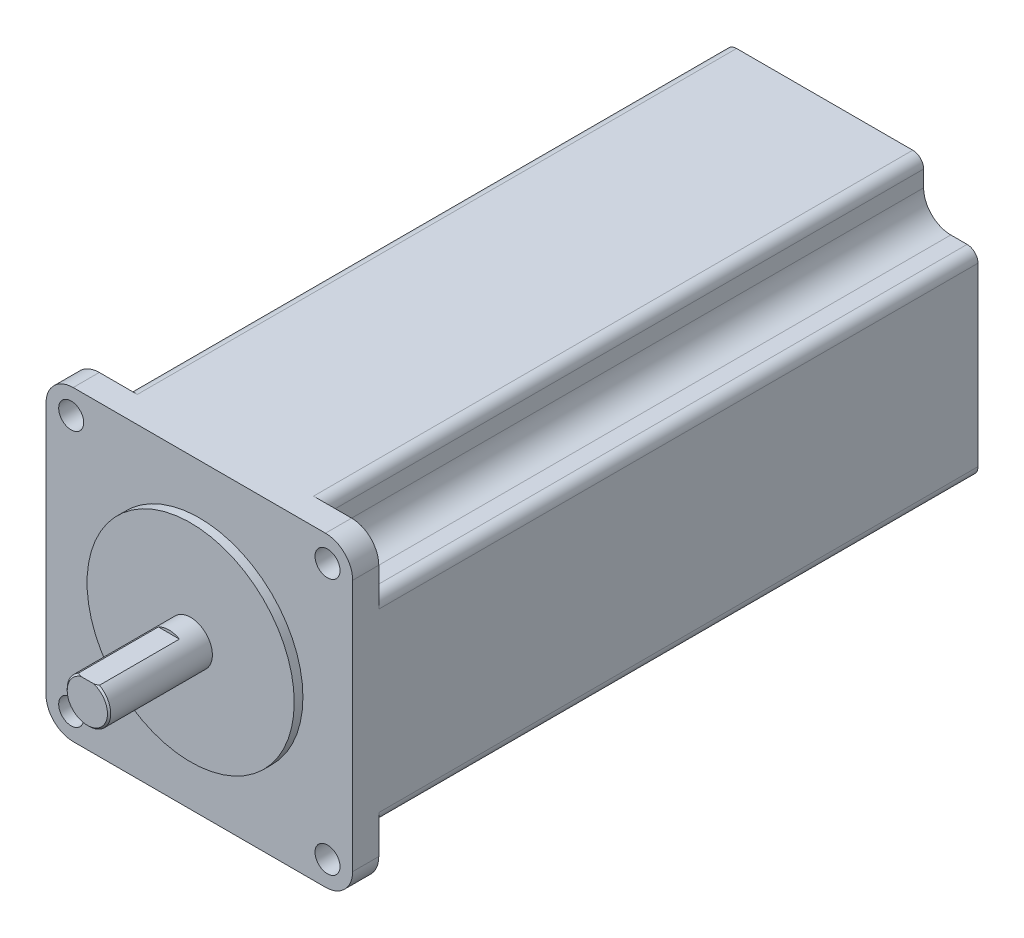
SolidWorks part; units mm, degrees
ref_plane "前视基准面" through (0, 0, 0) normal (0, 0, 1) x (1, 0, 0)
ref_plane "上视基准面" through (0, 0, 0) normal (0, 1, 0) x (1, 0, 0)
ref_plane "右视基准面" through (0, 0, 0) normal (1, 0, 0) x (0, 0, -1)
sketch "草图1" plane through (0, 0, 0) normal (0, 0, 1) x (1, 0, 0)
  circle A0 centre (0, 0) radius 19.05
extrude "凸台-拉伸1" add sketch "草图1" against normal blind 1.6
sketch "草图2" plane through (0, 0, 0) normal (0, 0, 1) x (1, 0, 0)
  circle A0 centre (0, 0) radius 4
extrude "凸台-拉伸2" add sketch "草图2" along normal blind 19
sketch "草图4" plane through (0, 0, -1.6) normal (0, 0, -1) x (-1, 0, 0)
  line L1 (0, 28.2) -> (23.2, 28.2)
  line L2 (28.2, 23.2) -> (28.2, -23.2)
  line L3 (23.2, -28.2) -> (-23.2, -28.2)
  line L4 (-28.2, -23.2) -> (-28.2, 23.2)
  line L5 (-23.2, 28.2) -> (0, 28.2)
  arc A0 (-23.2, -28.2) -> (-28.2, -23.2) centre (-23.2, -23.2) cw
  arc A1 (28.2, -23.2) -> (23.2, -28.2) centre (23.2, -23.2) cw
  arc A2 (23.2, 28.2) -> (28.2, 23.2) centre (23.2, 23.2) cw
  arc A3 (-28.2, 23.2) -> (-23.2, 28.2) centre (-23.2, 23.2) cw
  dimension "D1" = 5
extrude "凸台-拉伸3" add sketch "草图4" along normal blind 115
sketch "草图5" plane through (0, 0, -116.6) normal (0, 0, -1) x (-1, 0, 0)
  line L1 (23.2, 28.2) -> (-23.2, 28.2) construction
  line L2 (11.4944, 28.2) -> (16.2, 28.2)
  line L3 (18.2, 26.2) -> (18.2, 23.2)
  line L4 (23.2, 18.2) -> (26.2, 18.2)
  line L5 (28.2, -23.2) -> (28.2, 23.2) construction
  line L6 (28.2, 16.2) -> (28.2, 9.9204)
  line L7 (28.2, 9.9204) -> (36.4601, 9.9204)
  line L8 (36.4601, 9.9204) -> (36.4601, 32.1771)
  line L9 (36.4601, 32.1771) -> (11.4944, 32.1771)
  line L10 (11.4944, 32.1771) -> (11.4944, 28.2)
  line L12 (-11.4944, 32.1771) -> (-11.4944, 28.2)
  line L13 (-36.4601, 32.1771) -> (-11.4944, 32.1771)
  line L14 (-36.4601, 9.9204) -> (-36.4601, 32.1771)
  line L15 (-28.2, 9.9204) -> (-36.4601, 9.9204)
  line L16 (-28.2, 16.2) -> (-28.2, 9.9204)
  line L17 (-23.2, 18.2) -> (-26.2, 18.2)
  line L18 (-18.2, 26.2) -> (-18.2, 23.2)
  line L19 (-11.4944, 28.2) -> (-16.2, 28.2)
  line L20 (11.4944, -32.1771) -> (11.4944, -28.2)
  line L21 (36.4601, -32.1771) -> (11.4944, -32.1771)
  line L22 (36.4601, -9.9204) -> (36.4601, -32.1771)
  line L23 (28.2, -9.9204) -> (36.4601, -9.9204)
  line L24 (28.2, -16.2) -> (28.2, -9.9204)
  line L25 (23.2, -18.2) -> (26.2, -18.2)
  line L26 (18.2, -26.2) -> (18.2, -23.2)
  line L27 (11.4944, -28.2) -> (16.2, -28.2)
  line L28 (-11.4944, -28.2) -> (-16.2, -28.2)
  line L29 (-18.2, -26.2) -> (-18.2, -23.2)
  line L30 (-23.2, -18.2) -> (-26.2, -18.2)
  line L31 (-28.2, -16.2) -> (-28.2, -9.9204)
  line L32 (-28.2, -9.9204) -> (-36.4601, -9.9204)
  line L33 (-36.4601, -9.9204) -> (-36.4601, -32.1771)
  line L34 (-36.4601, -32.1771) -> (-11.4944, -32.1771)
  line L35 (-11.4944, -32.1771) -> (-11.4944, -28.2)
  arc A0 (18.2, 23.2) -> (23.2, 18.2) centre (23.2, 23.2) ccw
  arc A1 (26.2, 18.2) -> (28.2, 16.2) centre (26.2, 16.2) cw
  arc A2 (16.2, 28.2) -> (18.2, 26.2) centre (16.2, 26.2) cw
  arc A3 (-16.2, 28.2) -> (-18.2, 26.2) centre (-16.2, 26.2) ccw
  arc A4 (-26.2, 18.2) -> (-28.2, 16.2) centre (-26.2, 16.2) ccw
  arc A5 (-18.2, 23.2) -> (-23.2, 18.2) centre (-23.2, 23.2) cw
  arc A6 (16.2, -28.2) -> (18.2, -26.2) centre (16.2, -26.2) ccw
  arc A7 (26.2, -18.2) -> (28.2, -16.2) centre (26.2, -16.2) ccw
  arc A8 (18.2, -23.2) -> (23.2, -18.2) centre (23.2, -23.2) cw
  arc A9 (-18.2, -23.2) -> (-23.2, -18.2) centre (-23.2, -23.2) ccw
  arc A10 (-26.2, -18.2) -> (-28.2, -16.2) centre (-26.2, -16.2) cw
  arc A11 (-16.2, -28.2) -> (-18.2, -26.2) centre (-16.2, -26.2) cw
  point P20 (28.2, 18.2)
  point P23 (18.2, 28.2)
  point P38 (-18.2, 28.2)
  point P39 (-28.2, 18.2)
  point P54 (18.2, -28.2)
  point P55 (28.2, -18.2)
  point P70 (-28.2, -18.2)
  point P71 (-18.2, -28.2)
  dimension "D1" = 5
  dimension "D2" = 2
extrude "切除-拉伸2" cut sketch "草图5" against normal blind 110.2
sketch "草图6" plane through (0, 0, -1.6) normal (0, 0, 1) x (1, 0, 0)
  circle A0 centre (-23.57, 23.57) radius 2.3
  circle A1 centre (23.57, 23.57) radius 2.3
  circle A2 centre (23.57, -23.57) radius 2.3
  circle A3 centre (-23.57, -23.57) radius 2.3
extrude "切除-拉伸3" cut sketch "草图6" against normal blind 49.7
chamfer "倒角1" distance 0.3 angle 45 1 edges at (4, 0, 19)
sketch "草图9" plane through (0, 0, 19) normal (0, 0, 1) x (1, 0, 0)
  line L2 (-1.9365, 3.5) -> (1.9365, 3.5)
  circle A1 centre (0, 0) radius 4 construction
  arc A2 (1.9365, 3.5) -> (-1.9365, 3.5) centre (0, 0) ccw
extrude "切除-拉伸4" cut sketch "草图9" against normal blind 15
